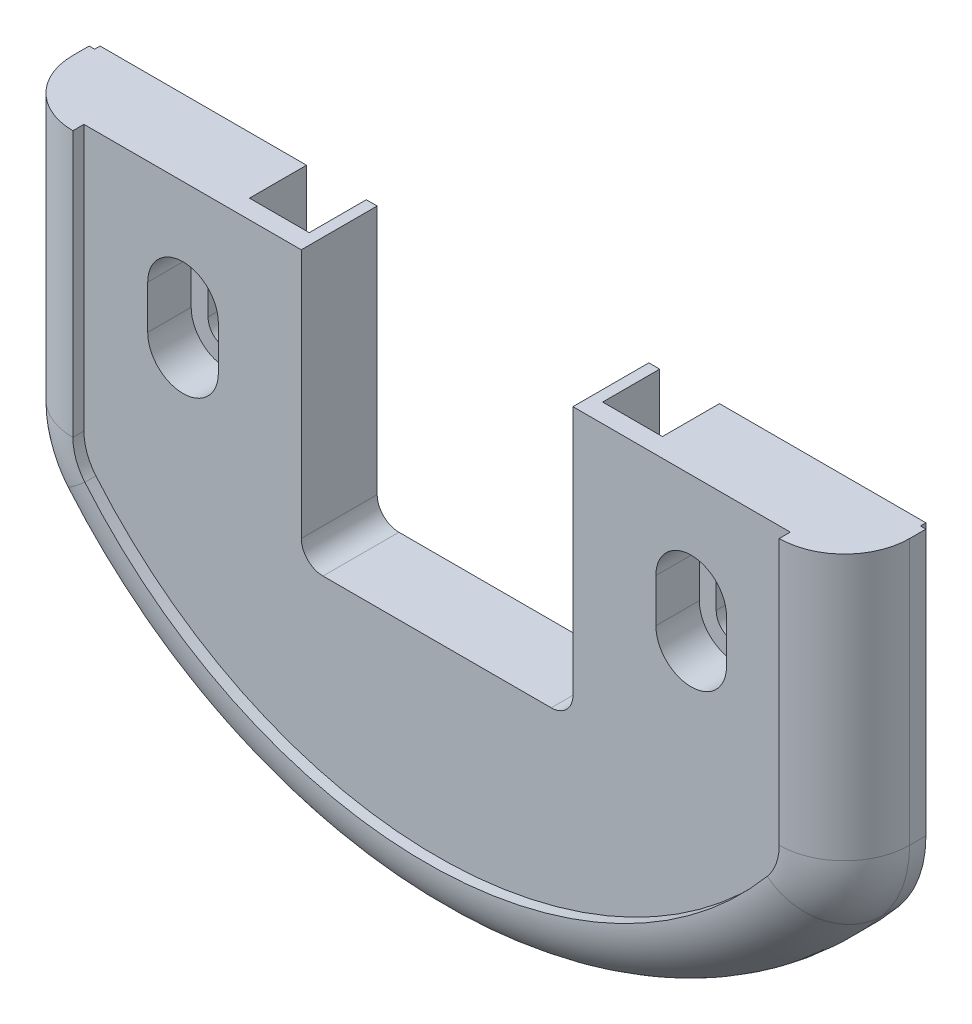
SolidWorks part; units mm, degrees
ref_plane "Front Plane" through (0, 0, 0) normal (0, 0, 1) x (1, 0, 0)
ref_plane "Top Plane" through (0, 0, 0) normal (0, 1, 0) x (1, 0, 0)
ref_plane "Right Plane" through (0, 0, 0) normal (1, 0, 0) x (0, 0, -1)
sketch "Sketch1" plane through (0, 0, 0) normal (0, 0, 1) x (1, 0, 0)
  line L0 (0, 0) -> (0, -1.104) construction
  line L1 (12.5, 0) -> (38.5, 0)
  line L2 (38.5, 0) -> (38.5, -24.4463)
  line L3 (12.5, 0) -> (12.5, -25)
  line L4 (12.5, -25) -> (-12.5, -25)
  line L5 (0, 0) -> (0, -48.104) construction
  line L6 (-38.5, 0) -> (-38.5, -24.4463)
  line L7 (-12.5, 0) -> (-38.5, 0)
  line L8 (-12.5, 0) -> (-12.5, -25)
  arc A0 (-35.9947, -31.3262) -> (35.9947, -31.3262) centre (0, -1.104) ccw
  arc A1 (38.5, -24.4463) -> (35.9947, -31.3262) centre (27.8008, -24.4463) cw
  arc A2 (-38.5, -24.4463) -> (-35.9947, -31.3262) centre (-27.8008, -24.4463) ccw
  point P17 (0, -25)
  dimension "D1" = 94
  dimension "D2" = 1.104
  dimension "D3" = 24.4463
  dimension "D4" = 77
  dimension "D5" = 25
  dimension "D6" = 25
extrude "Boss-Extrude1" add sketch "Sketch1" along normal blind 8
fillet "Fillet1" radius 6 5 edges at (-38.5, -12.2231, 8) (-37.8542, -28.1072, 8) (38.5, -12.2232, 8) (37.8542, -28.1072, 8) (0, -48.104, 8)
sketch "Sketch2" plane through (0, 0, 0) normal (0, 0, -1) x (-1, 0, 0)
  line L2 (-38.5, -24.4463) -> (-38.5, 0) construction
  line L3 (38.5, 0) -> (38.5, -24.4463) construction
  line L4 (-38, -24.4463) -> (-38, 0)
  line L5 (38, 0) -> (38, -24.4463)
  line L6 (-38, -24.4463) -> (-38, 0)
  line L7 (38, 0) -> (38, -24.4463)
  line L8 (-38.5, -24.4463) -> (-38.5, 0)
  line L9 (38.5, 0) -> (38.5, -24.4463)
  line L10 (-38.5, 0) -> (-38, 0)
  line L11 (38, 0) -> (38.5, 0)
  arc A3 (-38.5, -24.4463) -> (-35.9947, -31.3262) centre (-27.8008, -24.4463) ccw construction
  arc A4 (-35.9947, -31.3262) -> (35.9947, -31.3262) centre (0, -1.104) ccw construction
  arc A5 (35.9947, -31.3262) -> (38.5, -24.4463) centre (27.8008, -24.4463) ccw construction
  arc A6 (-38, -24.4463) -> (-35.6118, -31.0047) centre (-27.8008, -24.4463) ccw
  arc A7 (-35.6118, -31.0047) -> (35.6118, -31.0047) centre (0, -1.104) ccw
  arc A8 (35.6118, -31.0047) -> (38, -24.4463) centre (27.8008, -24.4463) ccw
  arc A9 (-38, -24.4463) -> (-35.6118, -31.0047) centre (-27.8008, -24.4463) ccw
  arc A10 (-35.6118, -31.0047) -> (35.6118, -31.0047) centre (0, -1.104) ccw
  arc A11 (35.6118, -31.0047) -> (38, -24.4463) centre (27.8008, -24.4463) ccw
  arc A12 (-38.5, -24.4463) -> (-35.9947, -31.3262) centre (-27.8008, -24.4463) ccw
  arc A13 (-35.9947, -31.3262) -> (35.9947, -31.3262) centre (0, -1.104) ccw
  arc A14 (35.9947, -31.3262) -> (38.5, -24.4463) centre (27.8008, -24.4463) ccw
  dimension "D1" = 0.5
extrude "Cut-Extrude1" cut sketch "Sketch2" against normal blind 0.5
sketch "Sketch3" plane through (0, 0, 8) normal (0, 0, 1) x (1, 0, 0)
  line L7 (-12.5, 0) -> (-32.5, 0)
  line L8 (-32.5, 0) -> (-32.5, -24.4463)
  line L9 (32.5, -24.4463) -> (32.5, 0)
  line L10 (-12.5, 0) -> (-32.5, 0)
  line L11 (32.5, 0) -> (12.5, 0)
  line L12 (32.5, 0) -> (12.5, 0)
  line L13 (12.5, 0) -> (12.5, -25)
  line L14 (12.5, 0) -> (12.5, -25)
  line L15 (-32.5, 0) -> (-32.5, -24.4463)
  line L16 (32.5, -24.4463) -> (32.5, 0)
  line L17 (12.5, -25) -> (-12.5, -25)
  line L18 (12.5, -25) -> (-12.5, -25)
  line L19 (-12.5, -25) -> (-12.5, 0)
  line L20 (-12.5, -25) -> (-12.5, 0)
  arc A3 (-32.5, -24.4463) -> (-31.3997, -27.468) centre (-27.8008, -24.4463) ccw
  arc A4 (-31.3997, -27.468) -> (31.3997, -27.468) centre (0, -1.104) ccw
  arc A5 (31.3997, -27.468) -> (32.5, -24.4463) centre (27.8008, -24.4463) ccw
  arc A6 (-32.5, -24.4463) -> (-31.3997, -27.468) centre (-27.8008, -24.4463) ccw
  arc A7 (-31.3997, -27.468) -> (31.3997, -27.468) centre (0, -1.104) ccw
  arc A8 (31.3997, -27.468) -> (32.5, -24.4463) centre (27.8008, -24.4463) ccw
  dimension "D1" = 0
extrude "Cut-Extrude2" cut sketch "Sketch3" against normal blind 1.016
hole_wizard "CBORE for M3 SHCS1" positions "Sketch5" profile "Sketch4" counterbore size "M3" standard "ANSI Metric"
sketch "Sketch5" plane through (0, 0, 6.984) normal (0, 0, 1) x (1, 0, 0)
  line L0 (-12.5, 0) -> (-32.5, 0) construction
  line L1 (-12.5, -25) -> (-12.5, 0) construction
  point P0 (-23.3811, -11.643)
  dimension "D1" = 11.643
  dimension "D2" = 10.8811
sketch "Sketch4" plane through (-23.3811, -11.643, 6.984) normal (1, 0, 0) x (0, -1, 0)
  line L0 (0, 0) -> (0, 6.984)
  line L1 (0, 6.984) -> (1.7, 6.984)
  line L3 (1.7, 6.984) -> (1.7, 4)
  line L4 (1.7, 4) -> (3.25, 4)
  line L5 (3.25, 4) -> (3.25, 0)
  line L7 (3.25, 0) -> (0, 0)
  line L11 (0, -6.35) -> (0, 107.95) construction
  dimension "Thru Hole Dia." = 3.4
  dimension "Thru Hole Depth" = 6.984
  dimension "C'Bore Dia." = 6.5
  dimension "C'Bore Depth" = 4
mirror "Mirror1" about plane through (0, 0, 0) normal (1, 0, 0) of "CBORE for M3 SHCS1"
sketch "Sketch6" plane through (0, 0, 0) normal (0, 0, -1) x (-1, 0, 0)
  line L0 (12.5, 0) -> (38, 0) construction
  line L1 (0, 0) -> (0, -25) construction
  line L2 (13.5, 0) -> (19, 0)
  line L3 (13.5, 0) -> (13.5, -20)
  line L4 (13.5, -20) -> (19, -20)
  line L5 (19, 0) -> (19, -20)
  line L6 (-12.5, -25) -> (12.5, -25) construction
  line L7 (-19, 0) -> (-19, -20)
  line L8 (-13.5, -20) -> (-19, -20)
  line L9 (-13.5, 0) -> (-13.5, -20)
  line L10 (-13.5, 0) -> (-19, 0)
  line L11 (12.5, -25) -> (12.5, 0) construction
  dimension "D1" = 5.5
  dimension "D2" = 20
  dimension "D3" = 1
extrude "Cut-Extrude3" cut sketch "Sketch6" against normal blind 5.25
fillet "Fillet2" radius 2 6 edges at (13.5, -20, 2.625) (19, -20, 2.625) (12.5, -25, 3.492) (-12.5, -25, 3.492) (-13.5, -20, 2.625) (-19, -20, 2.625)
ref_plane "Plane1" through (16.25, 0, 0) normal (-1, 0, 0) x (0, 0, 1)
ref_plane "Plane2" through (-16.25, 0, 0) normal (1, 0, 0) x (0, 0, -1)
sketch "Sketch8" plane through (0, 0, 6.984) normal (0, 0, 1) x (1, 0, 0)
  line L0 (-23.3811, -13.643) -> (-23.3811, -9.643) construction
  line L1 (-26.6311, -13.643) -> (-26.6311, -9.643)
  line L2 (-20.1311, -13.643) -> (-20.1311, -9.643)
  line L3 (0, 0) -> (0, -16.8092) construction
  line L4 (23.3811, -13.643) -> (23.3811, -9.643) construction
  line L5 (26.6311, -13.643) -> (26.6311, -9.643)
  line L6 (20.1311, -13.643) -> (20.1311, -9.643)
  arc A0 (-26.6311, -13.643) -> (-20.1311, -13.643) centre (-23.3811, -13.643) ccw
  arc A1 (-20.1311, -9.643) -> (-26.6311, -9.643) centre (-23.3811, -9.643) ccw
  circle A2 centre (-23.3811, -11.643) radius 3.25 construction
  arc A3 (26.6311, -13.643) -> (20.1311, -13.643) centre (23.3811, -13.643) cw
  arc A4 (20.1311, -9.643) -> (26.6311, -9.643) centre (23.3811, -9.643) cw
  point P2 (-23.3811, -11.643)
  point P15 (23.3811, -11.643)
  dimension "D1" = 4
extrude "Cut-Extrude4" cut sketch "Sketch8" against normal up to surface (4 mm away)
sketch "Sketch9" plane through (0, 0, 2.984) normal (0, 0, 1) x (1, 0, 0)
  line L0 (-23.3811, -13.643) -> (-23.3811, -9.643) construction
  line L1 (-25.0811, -13.643) -> (-25.0811, -9.643)
  line L2 (-21.6811, -13.643) -> (-21.6811, -9.643)
  line L3 (0, 0) -> (0, -15.0599) construction
  line L4 (23.3811, -13.643) -> (23.3811, -9.643) construction
  line L5 (25.0811, -13.643) -> (25.0811, -9.643)
  line L6 (21.6811, -13.643) -> (21.6811, -9.643)
  arc A0 (-25.0811, -13.643) -> (-21.6811, -13.643) centre (-23.3811, -13.643) ccw
  arc A1 (-21.6811, -9.643) -> (-25.0811, -9.643) centre (-23.3811, -9.643) ccw
  circle A2 centre (-23.3811, -11.643) radius 1.7 construction
  arc A3 (-20.1311, -9.643) -> (-26.6311, -9.643) centre (-23.3811, -9.643) ccw construction
  arc A4 (25.0811, -13.643) -> (21.6811, -13.643) centre (23.3811, -13.643) cw
  arc A5 (21.6811, -9.643) -> (25.0811, -9.643) centre (23.3811, -9.643) cw
  point P2 (-23.3811, -11.643)
  point P18 (23.3811, -11.643)
extrude "Cut-Extrude5" cut sketch "Sketch9" against normal through all
